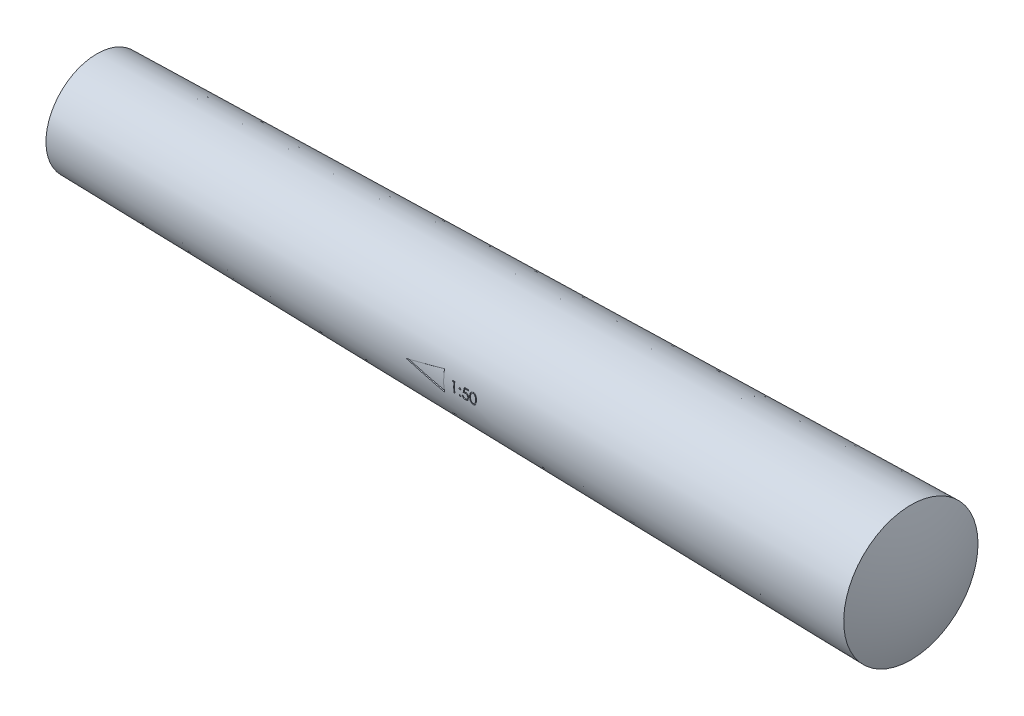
SolidWorks part; units mm, degrees
ref_plane "Front Plane" through (0, 0, 0) normal (0, 0, 1) x (1, 0, 0)
ref_plane "Top Plane" through (0, 0, 0) normal (0, 1, 0) x (1, 0, 0)
ref_plane "Right Plane" through (0, 0, 0) normal (1, 0, 0) x (0, 0, -1)
sketch "Sketch1" plane through (0, 0, 0) normal (1, 0, 0) x (0, 0, -1)
  circle A0 centre (0, 0) radius 5
  dimension "D1" = 10
extrude "Extrude1" add sketch "Sketch1" along normal mid plane 80
draft "Draft1" type of draft neutral plane draft angle 1.146 faces to draft 1 parameters "D1"=1.146
sketch "Sketch2" plane through (0, 0, 0) normal (0, 0, 1) x (1, 0, 0)
  line L0 (-40, 0) -> (-40, 5)
  line L1 (-40, 5) -> (-40, -5) construction
  line L2 (-40, 0) -> (-41.2, 0)
  line L3 (-41.2, 0) -> (-41.2, -5.8) construction
  line L4 (40, 0) -> (40, 6.6001)
  line L5 (40, -6.6001) -> (40, 6.6001) construction
  line L6 (40, 0) -> (41.2, 0)
  line L7 (41.2, 0) -> (41.2, -5.8) construction
  line L8 (-40, -5) -> (40, -6.6001) construction
  arc A0 (-41.2, 0) -> (-40, 5) centre (-30.1833, 0) cw
  arc A1 (41.2, 0) -> (40, 6.6001) centre (22.4497, 0) ccw
  point P14 (0, -5.8)
revolve "Revolve1" add sketch "Sketch2" angle 360 about L2
sketch "Sketch5" plane through (0, 0, 0) normal (0, 0, 1) x (1, 0, 0)
  line L0 (0, 5.8) -> (0, -5.8) construction
  line L1 (40, 6.6001) -> (-40, 5) construction
  line L2 (-40, -5) -> (40, -6.6001) construction
ref_plane "Plane2" through (0, 0, 0) normal (-0.02, 0, 0.9998) x (0.9998, 0, 0.02)
sketch "Sketch6" plane through (0, 0, 0) normal (-0.02, 0, 0.9998) x (0.9998, 0, 0.02)
  line L0 (0, 0) -> (0, 1)
  line L1 (0, 5.8) -> (0, -5.8) construction
  line L2 (0, 1) -> (-3.7321, 0)
  line L3 (-3.7321, 0) -> (0, -1)
  line L4 (0, -1) -> (0, 0)
  line L5 (0, -0.5) -> (4, -0.5) construction
  text T0 "1:50" font "Century Gothic" height 1
  dimension "D1" = 2
  dimension "D2" = 30
  dimension "D3" = 4
wrap "Wrap2" sketch "Sketch6" wrap type deboss source sketch "Sketch6" thickness 0.1 parameters "D1"=0.1
equation "\"D2@Sketch2\" = \"D1@Sketch2\""
